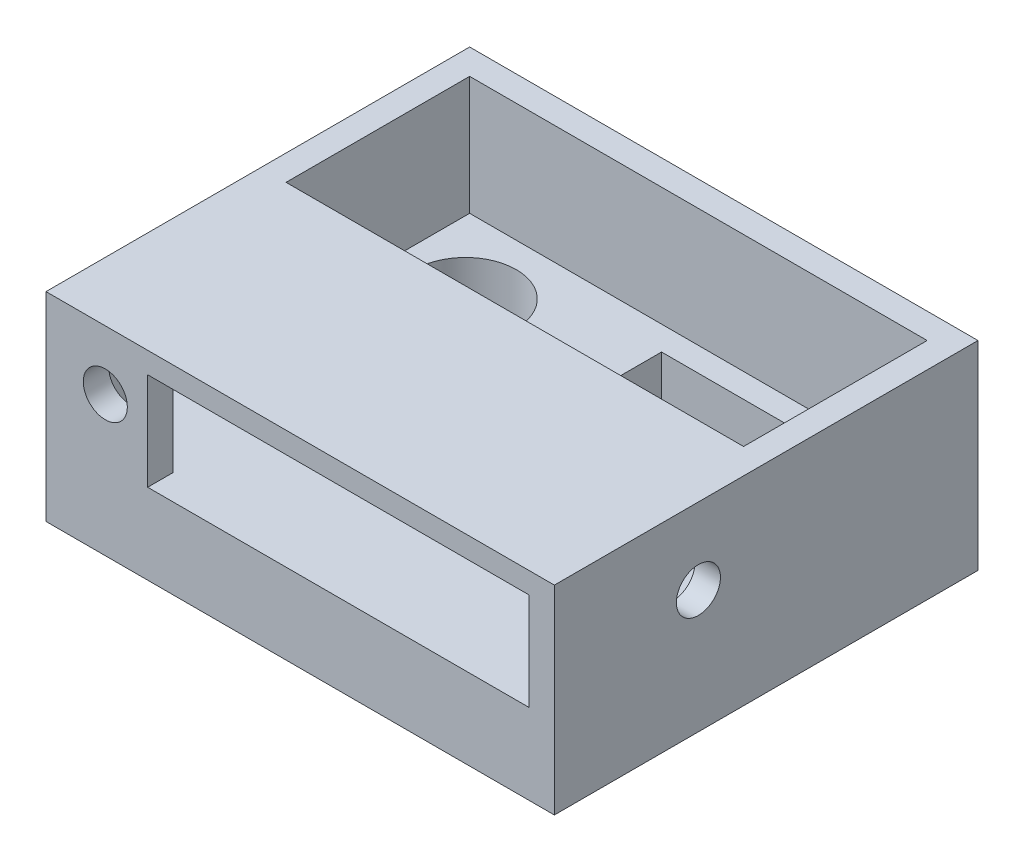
SolidWorks part; units mm, degrees
ref_plane "Plan de face" through (0, 0, 0) normal (0, 0, 1) x (1, 0, 0)
ref_plane "Plan de dessus" through (0, 0, 0) normal (0, 1, 0) x (1, 0, 0)
ref_plane "Plan de droite" through (0, 0, 0) normal (1, 0, 0) x (0, 0, -1)
sketch "Esquisse1" plane through (0, 0, 0) normal (0, 1, 0) x (1, 0, 0)
  line L1 (0, 0) -> (60, 0)
  line L2 (0, 0) -> (0, -50)
  line L3 (0, -50) -> (60, -50)
  line L4 (60, 0) -> (60, -50)
  dimension "D1" = 60
  dimension "D2" = 50
extrude "Boss.-Extru.1" add sketch "Esquisse1" along normal blind 21
sketch "Esquisse2" plane through (0, 21, 0) normal (0, 1, 0) x (1, 0, 0)
  line L0 (0, 0) -> (0, -50) construction
  line L1 (3, -3) -> (57, -3)
  line L2 (3, -3) -> (3, -47)
  line L3 (3, -47) -> (57, -47)
  line L4 (57, -3) -> (57, -47)
  line L5 (60, -50) -> (60, 0) construction
  line L6 (60, 0) -> (0, 0) construction
  line L7 (0, -50) -> (60, -50) construction
  dimension "D1" = 3
  dimension "D2" = 3
  dimension "D3" = 3
  dimension "D4" = 3
extrude "Enlèv. mat.-Extru.1" cut sketch "Esquisse2" against normal blind 14
sketch "Esquisse3" plane through (0, 7, 0) normal (0, 1, 0) x (1, 0, 0)
  line L0 (3, -25) -> (57, -25) construction
  line L1 (28.5, -5.85) -> (51.5, -5.85)
  line L2 (28.5, -5.85) -> (28.5, -18.15)
  line L3 (28.5, -18.15) -> (51.5, -18.15)
  line L4 (51.5, -5.85) -> (51.5, -18.15)
  line L5 (3, -3) -> (3, -47) construction
  line L6 (57, -47) -> (57, -3) construction
  line L7 (30, -3) -> (30, -47) construction
  line L8 (57, -3) -> (3, -3) construction
  line L9 (3, -47) -> (57, -47) construction
  line L10 (28.5, -12) -> (51.5, -12) construction
  line L11 (40, -5.85) -> (40, -18.15) construction
  dimension "D1" = 10
  dimension "D2" = 23
  dimension "D3" = 12.3
  dimension "D4" = 13
extrude "Enlèv. mat.-Extru.2" cut sketch "Esquisse3" against normal up to next
sketch "Esquisse4" plane through (60, 0, 0) normal (1, 0, 0) x (0, 0, -1)
  line L0 (-50, 10.5) -> (0, 10.5) construction
  line L1 (-50, 21) -> (-50, 0) construction
  line L2 (0, 21) -> (0, 0) construction
  line L3 (-25, 21) -> (-25, 0) construction
  line L4 (-50, 21) -> (0, 21) construction
  line L5 (-50, 0) -> (0, 0) construction
  circle A0 centre (-33, 12) radius 2.6
  dimension "D1" = 5.2
  dimension "D2" = 1.5
  dimension "D3" = 8
extrude "Enlèv. mat.-Extru.3" cut sketch "Esquisse4" against normal blind 10
sketch "Esquisse5" plane through (0, 0, 0) normal (0, -1, 0) x (1, 0, 0)
  line L0 (28.5, 5.85) -> (51.5, 5.85) construction
  line L1 (60, 0) -> (0, 0)
  line L2 (60, 0) -> (60, 50)
  line L3 (60, 50) -> (0, 50)
  line L4 (0, 0) -> (0, 50)
  line L5 (56.5, 5.85) -> (23.5, 5.85)
  line L6 (56.5, 5.85) -> (56.5, 18.15)
  line L7 (56.5, 18.15) -> (23.5, 18.15)
  line L8 (23.5, 5.85) -> (23.5, 18.15)
  line L9 (51.5, 18.15) -> (28.5, 18.15) construction
  line L10 (51.5, 5.85) -> (51.5, 18.15) construction
  line L11 (28.5, 18.15) -> (28.5, 5.85) construction
  dimension "D1" = 5
  dimension "D2" = 5
extrude "Boss.-Extru.2" add sketch "Esquisse5" along normal blind 2.5
sketch "Esquisse6" plane through (0, 0, 50) normal (0, 0, 1) x (1, 0, 0)
  line L0 (0, 21) -> (60, 21) construction
  line L2 (0, 21) -> (0, -2.5) construction
  circle A0 centre (7, 14) radius 2.6
  dimension "D1" = 5.2
  dimension "D3" = 7
  dimension "D2" = 7
extrude "Enlèv. mat.-Extru.4" cut sketch "Esquisse6" against normal blind 10
sketch "Esquisse8" plane through (0, 21, 0) normal (0, 1, 0) x (1, 0, 0)
  line L0 (0, -50) -> (60, -50) construction
  line L1 (0, -50) -> (60, -50)
  line L2 (0, -50) -> (0, -24.6679)
  line L3 (0, -24.6679) -> (60, -24.6679)
  line L4 (60, -50) -> (60, -24.6679)
  line L5 (60, -50) -> (60, 0) construction
extrude "Boss.-Extru.3" add sketch "Esquisse8" against normal blind 2.5
sketch "Esquisse9" plane through (0, 0, 50) normal (0, 0, 1) x (1, 0, 0)
  line L1 (57, 18.5) -> (12, 18.5)
  line L2 (57, 18.5) -> (57, 7)
  line L3 (57, 7) -> (12, 7)
  line L4 (12, 18.5) -> (12, 7)
  line L5 (0, 21) -> (60, 21) construction
  line L6 (60, 21) -> (60, -2.5) construction
  line L11 (3, 7) -> (57, 7) construction
  dimension "D1" = 2.5
  dimension "D2" = 45
  dimension "D3" = 3
extrude "Enlèv. mat.-Extru.6" cut sketch "Esquisse9" against normal blind 3
sketch "Esquisse10" plane through (0, -2.5, 0) normal (0, -1, 0) x (-1, 0, 0)
  line L0 (-23.5, -12) -> (6.0842, -12) construction
  line L1 (-23.5, -18.15) -> (-23.5, -5.85) construction
  circle A0 centre (-11.5, -12) radius 6
  dimension "D2" = 12
  dimension "D1" = 12
extrude "Enlèv. mat.-Extru.7" cut sketch "Esquisse10" against normal up to surface (9.5 mm away)
